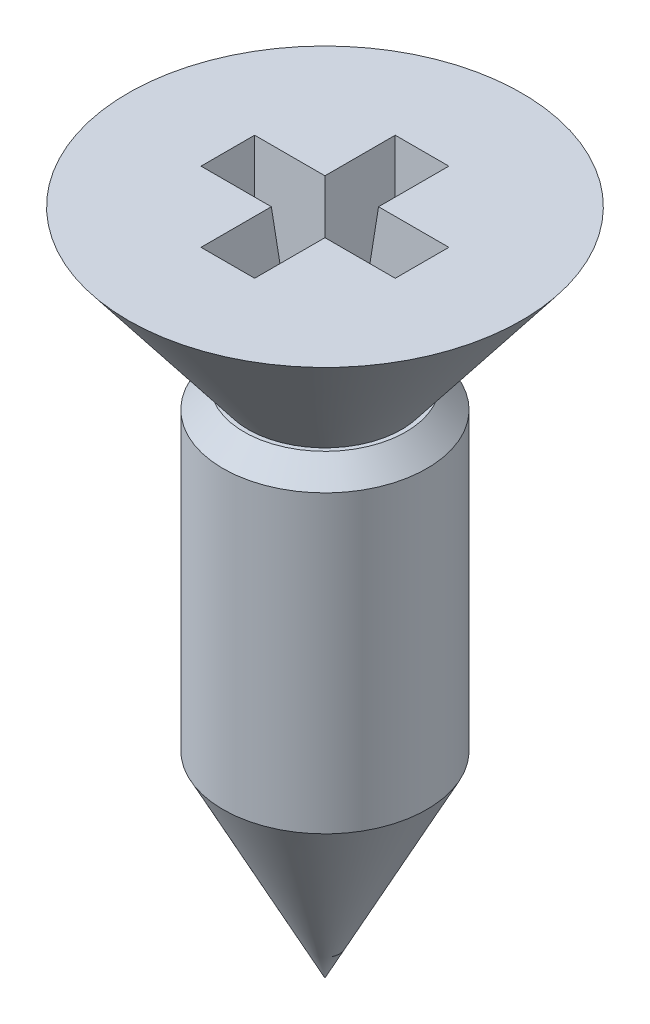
SolidWorks part; units mm, degrees
ref_plane "Face" through (0, 0, 0) normal (0, 0, 1) x (1, 0, 0)
ref_plane "Dessus" through (0, 0, 0) normal (0, 1, 0) x (1, 0, 0)
ref_plane "Droite" through (0, 0, 0) normal (1, 0, 0) x (0, 0, -1)
sketch "Esquisse1" plane through (0, 0, 0) normal (0, 0, 1) x (1, 0, 0)
  line L0 (0, 0) -> (0, -19.0471) construction
  line L1 (0, -3.4482) -> (2.8, -3.4482)
  line L2 (1.45, -5.6482) -> (1.45, -10.1482)
  line L3 (1.09, -5.6482) -> (2.8, -3.4482)
  line L5 (1.09, -5.6482) -> (1.45, -5.6482)
  line L7 (1.45, -10.1482) -> (0, -12.9482)
  line L8 (0, -3.4482) -> (0, -12.9482)
  dimension "D2" = 2.8
  dimension "D3" = 2.7864
  dimension "D4" = 0.36
  dimension "D5" = 3.1532
  dimension "D6" = 9.5
revolve "Révolution1" add sketch "Esquisse1" angle 360 about L0
chamfer "Chanfrein2" distance 0.3 angle 45 1 edges at (0, -5.6482, 1.45)
sketch "Esquisse2" plane through (0, -3.4482, 0) normal (0, 1, 0) x (-1, 0, 0)
  line L0 (0, 3.144) -> (0, -3.0562) construction
  line L1 (3.2044, 0) -> (-3.2702, 0) construction
  line L2 (0.25, -1.25) -> (-0.25, -1.25)
  line L3 (-0.25, -1.25) -> (-0.25, -0.25)
  line L4 (-1.25, -0.25) -> (-1.25, 0.25)
  line L5 (-1.25, 0.25) -> (-0.25, 0.25)
  line L6 (-0.25, 0.25) -> (-0.25, 1.25)
  line L7 (-0.25, 1.25) -> (0.25, 1.25)
  line L8 (0.25, 1.25) -> (0.25, 0.25)
  line L9 (0.25, 0.25) -> (1.25, 0.25)
  line L10 (1.25, 0.25) -> (1.25, -0.25)
  line L11 (1.25, -0.25) -> (0.25, -0.25)
  line L12 (0.25, -0.25) -> (0.25, -1.25)
  line L13 (-0.25, -0.25) -> (-1.25, -0.25)
  dimension "D1" = 0.5
  dimension "D2" = 0.5
  dimension "D3" = 0.5
  dimension "D4" = 1
  dimension "D5" = 1
extrude "Enlèv. mat.-Extru.1" cut sketch "Esquisse2" against normal blind 1.5
draft "Dépouille1" type of draft neutral plane draft angle 5 faces to draft 12 parameters "D1"=5
